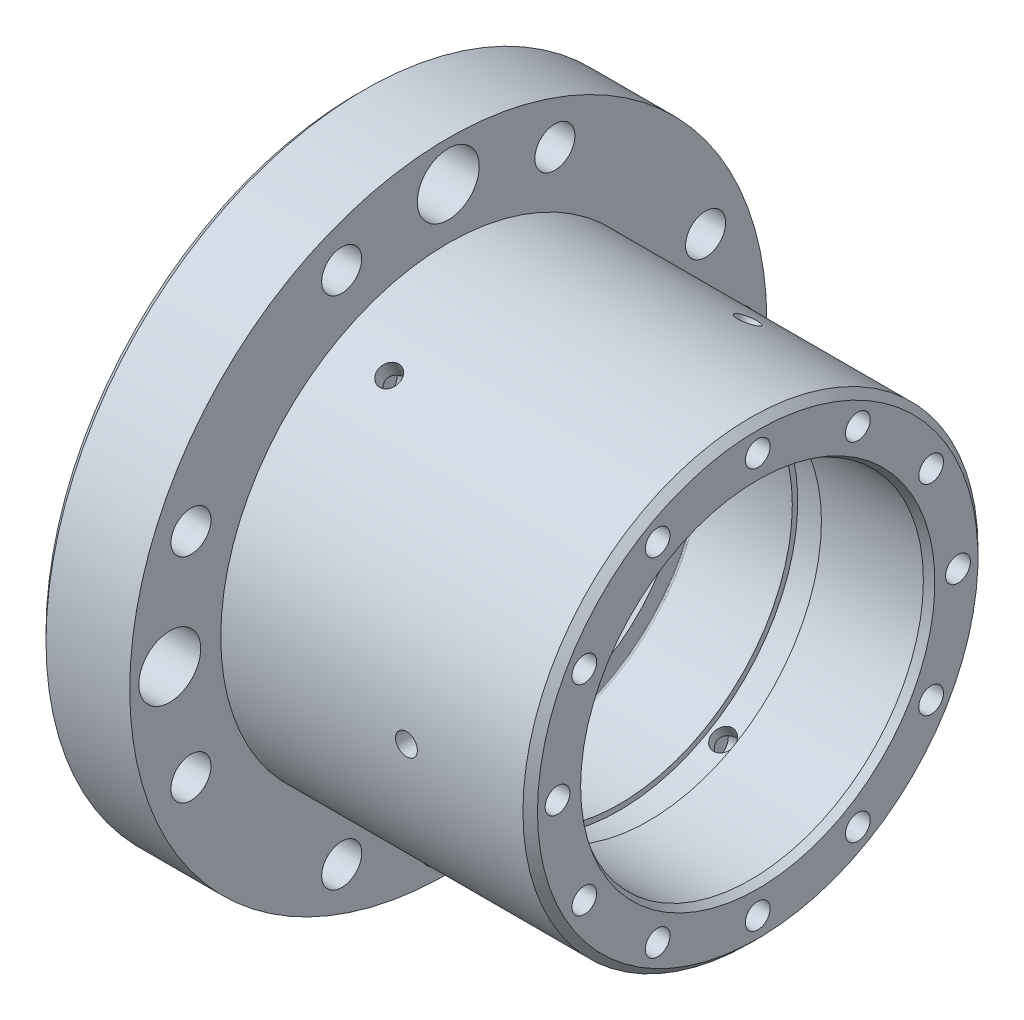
SolidWorks part; units mm, degrees
ref_plane "Plan de face" through (0, 0, 0) normal (0, 0, 1) x (1, 0, 0)
ref_plane "Plan de dessus" through (0, 0, 0) normal (0, 1, 0) x (1, 0, 0)
ref_plane "Plan de droite" through (0, 0, 0) normal (1, 0, 0) x (0, 0, -1)
sketch "Esquisse1" plane through (0, 0, 0) normal (0, 1, 0) x (1, 0, 0)
  line L0 (-52.7507, 100.253) -> (-52.7507, 72.253)
  line L1 (-50.7507, 102.253) -> (-27.7507, 102.253)
  line L3 (-52.7507, 100.253) -> (-50.7507, 102.253)
  line L5 (57.2493, 75.253) -> (57.2493, 63.4077)
  line L6 (-27.7507, 77.253) -> (55.2493, 77.253)
  line L8 (55.2493, 77.253) -> (57.2493, 75.253)
  line L10 (-27.7507, 102.253) -> (-27.7507, 77.253)
  line L12 (-5.3507, 62.253) -> (19.2493, 62.253)
  line L14 (-5.7507, 61.853) -> (-5.7507, 57.1964)
  line L16 (55.2493, 62.253) -> (57.2493, 63.4077)
  line L18 (-52.7507, 14.753) -> (109.5863, 14.753) construction
  line L20 (-22.7507, 56.853) -> (-22.7507, 55.753)
  line L21 (19.2493, 63.753) -> (27.2493, 63.753)
  line L23 (27.2493, 62.253) -> (55.2493, 62.253)
  line L25 (19.2493, 63.753) -> (19.2493, 62.253)
  line L26 (27.2493, 63.753) -> (27.2493, 62.253)
  line L34 (-52.7507, 72.253) -> (-47.7507, 72.253)
  line L36 (-47.7507, 72.253) -> (-47.7507, 58.1191)
  line L37 (-46.2507, 57.253) -> (-23.1507, 57.253)
  line L42 (-46.2507, 57.253) -> (-47.7507, 58.1191)
  line L45 (-22.7507, 55.753) -> (-8.2507, 55.753)
  line L48 (-8.2507, 55.753) -> (-5.7507, 57.1964)
  arc A0 (-5.3507, 62.253) -> (-5.7507, 61.853) centre (-5.3507, 61.853) ccw
  arc A2 (-22.7507, 56.853) -> (-23.1507, 57.253) centre (-23.1507, 56.853) ccw
revolve "Révolution1" add sketch "Esquisse1" angle 360 about L18
sketch "Esquisse2" plane through (-52.7507, 0, 0) normal (-1, 0, 0) x (0, 0, 1)
  line L0 (-14.753, 104.0762) -> (-14.753, -22.2553) construction
  circle A0 centre (-14.753, 0) radius 76.5 construction
  circle A1 centre (-14.753, 76.5) radius 8.5
  circle A2 centre (61.747, 0) radius 8.5
  circle A3 centre (-14.753, -76.5) radius 8.5
  circle A4 centre (-91.253, 0) radius 8.5
  dimension "D1" = 153
  dimension "D2" = 17
extrude "Extrusion1" cut sketch "Esquisse2" against normal blind 62
sketch "Esquisse3" plane through (-52.7507, 0, 0) normal (-1, 0, 0) x (0, 0, 1)
  line L0 (-14.753, 0) -> (-14.753, 98.2509) construction
  line L1 (-14.753, 0) -> (-52.1291, 90.2338) construction
  circle A0 centre (-44.0283, 70.6768) radius 8.5
  circle A1 centre (-14.753, 0) radius 76.5 construction
  dimension "D2" = 17
  dimension "D1" = 22.5
extrude "Extrusion2" cut sketch "Esquisse3" against normal blind 10
sketch "Esquisse4" plane through (-42.7507, 0, 0) normal (-1, 0, 0) x (0, 0, 1)
  circle A0 centre (-44.0283, 70.6768) radius 5.5
  dimension "D1" = 11
extrude "Extrusion3" cut sketch "Esquisse4" against normal blind 21
pattern_circular "Répétition circulaire1" count 2 every 45 about axis through (-47.7507, 0, -14.753) along (-1, 0, 0) of "Extrusion3", "Extrusion2"
pattern_circular "Répétition circulaire2" count 4 every 90 about axis through (0, 0, -14.753) along (1, 0, 0) of "Répétition circulaire1", "Extrusion2", "Extrusion3"
sketch "Esquisse5" plane through (-47.7507, 0, 0) normal (-1, 0, 0) x (0, 0, 1)
  line L0 (-14.753, 0) -> (-14.753, 94.7759) construction
  line L1 (-14.753, 0) -> (34.1781, 84.7511) construction
  line L2 (-14.753, 0) -> (-67.0555, 90.5904) construction
  circle A0 centre (-14.753, 0) radius 48.5 construction
  point P4 (-14.753, 48.5)
  dimension "D1" = 97
  dimension "D2" = 30
  dimension "D3" = 30
hole_wizard "Trou taraudé M61" positions "Esquisse3D1" profile "Esquisse6" tap size "M6" standard "ISO"
sketch3d "Esquisse3D1"
  point P0 (-47.7507, 48.5, -14.753)
sketch "Esquisse6" plane through (-47.7507, 48.5, -14.753) normal (0, 1, 0) x (0, 0, 1)
  line L0 (0, 0) -> (0, 19.5022)
  line L1 (0, 19.5022) -> (2.5, 18)
  line L2 (2.5, 18) -> (2.5, 0)
  line L5 (2.5, 0) -> (0, 0)
  line L10 (0, 19.5022) -> (-2.5, 18) construction
  line L11 (0, -6.35) -> (0, 107.95) construction
  dimension "Diamètre du trou pour taraudage" = 5
  dimension "Profondeur du trou pour taraudage" = 18
  dimension "Angle de pointe" = 118
pattern_circular "Répétition circulaire3" count 3 over 360 about axis through (0, 0, -14.753) along (1, 0, 0) of "Trou taraudé M61"
sketch "Esquisse8" plane through (57.2493, 0, 0) normal (1, 0, 0) x (0, 0, -1)
  line L0 (14.753, 0) -> (14.753, 94.7759) construction
  line L1 (14.753, 0) -> (-34.1781, 84.7511) construction
  line L2 (14.753, 0) -> (67.0555, 90.5904) construction
  circle A0 centre (14.753, 0) radius 55 construction
  point P3 (14.753, 55)
  point P4 (-12.747, 47.6314)
  point P7 (42.253, 47.6314)
  dimension "D1" = 110
hole_wizard "Trou taraudé M81" positions "Esquisse3D2" profile "Esquisse9" tap size "M8" standard "ISO"
sketch3d "Esquisse3D2"
  point P0 (57.2493, 55, -14.753)
sketch "Esquisse9" plane through (57.2493, 55, -14.753) normal (0, 1, 0) x (0, 0, -1)
  line L0 (0, 0) -> (0, 21.7929)
  line L1 (0, 21.7929) -> (3.4, 19.75)
  line L2 (3.4, 19.75) -> (3.4, 0)
  line L5 (3.4, 0) -> (0, 0)
  line L10 (0, 21.7929) -> (-3.4, 19.75) construction
  line L11 (0, -6.35) -> (0, 107.95) construction
  dimension "Diamètre du trou pour taraudage" = 6.8
  dimension "Profondeur du trou pour taraudage" = 19.75
  dimension "Angle de pointe" = 118
pattern_circular "Répétition circulaire4" count 6 over 360 about axis through (0, 0, -14.753) along (1, 0, 0) of "Trou taraudé M81"
sketch "Esquisse10" plane through (57.2493, 0, 0) normal (1, 0, 0) x (0, 0, -1)
  circle A0 centre (-12.747, 47.6314) radius 3.4
  dimension "D1" = 6.8
extrude "Extrusion4" cut sketch "Esquisse10" against normal blind 75
pattern_circular "Répétition circulaire5" count 3 over 360 about axis through (0, 0, -14.753) along (1, 0, 0) of "Extrusion4"
ref_plane "Plan2" through (0, -6.3883, -11.0648) normal (0, 0.5, 0.866) x (-1, 0, 0)
ref_plane "Plan3" through (0, 6.3883, -11.0648) normal (0, -0.5, 0.866) x (-1, 0, 0)
ref_plane "Plan4" through (13.7493, 54.1266, 16.497) normal (0, 0.866, 0.5) x (0, 0.5, -0.866)
sketch "Esquisse11" plane through (13.7493, 54.1266, 16.497) normal (0, 0.866, 0.5) x (0, 0.5, -0.866)
  line L0 (0, -41.5) -> (0, -13.5) construction
  line L1 (0, -13.5) -> (0, -5.5) construction
  line L2 (-55, -43.5) -> (55, -43.5) construction
  circle A0 centre (0, 26.5) radius 3
  dimension "D1" = 6
  dimension "D2" = 70
extrude "Extrusion5" cut sketch "Esquisse11" against normal blind 34
ref_plane "Plan5" through (13.7493, 54.1266, -46.003) normal (0, 0.866, -0.5) x (0, -0.5, -0.866)
sketch "Esquisse12" plane through (13.7493, 54.1266, -46.003) normal (0, 0.866, -0.5) x (0, -0.5, -0.866)
  line L0 (0, -41.5) -> (0, -13.5) construction
  line L1 (-55, -43.5) -> (55, -43.5) construction
  circle A0 centre (0, -9.5) radius 3
  dimension "D1" = 6
  dimension "D2" = 34
extrude "Extrusion6" cut sketch "Esquisse12" against normal blind 34
sketch "Esquisse13" plane through (57.2493, 0, 0) normal (1, 0, 0) x (0, 0, -1)
  line L0 (14.753, 95.4577) -> (14.753, 0) construction
  line L1 (14.753, 0) -> (65.7805, 88.3822) construction
  circle A0 centre (42.253, 47.6314) radius 3.4
  dimension "D1" = 6.8
extrude "Extrusion7" cut sketch "Esquisse13" against normal blind 39
pattern_circular "Répétition circulaire6" count 3 over 360 about axis through (0, 0, -14.753) along (1, 0, 0) of "Extrusion7", "Extrusion6"
pattern_circular "Répétition circulaire7" count 3 over 360 about axis through (55.2493, 0, -14.753) along (-1, 0, 0) of "Extrusion5"
